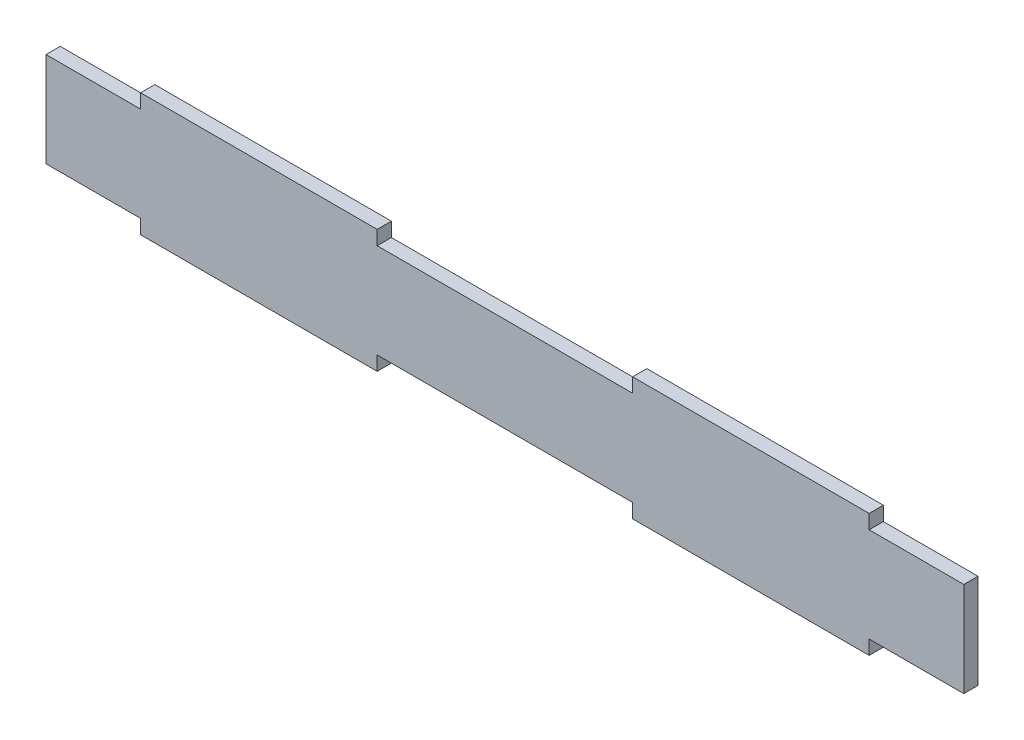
SolidWorks part; units mm, degrees
ref_plane "Front Plane" through (0, 0, 0) normal (0, 0, 1) x (1, 0, 0)
ref_plane "Top Plane" through (0, 0, 0) normal (0, 1, 0) x (1, 0, 0)
ref_plane "Right Plane" through (0, 0, 0) normal (1, 0, 0) x (0, 0, -1)
sketch "Sketch1" plane through (0, 0, 0) normal (0, 0, 1) x (1, 0, 0)
  line L0 (0, 20) -> (20, 20) construction
  line L1 (0, 0) -> (194, 0)
  line L2 (0, 0) -> (0, 20)
  line L3 (0, 20) -> (194, 20)
  line L4 (194, 0) -> (194, 20)
  line L5 (97, 20) -> (97, 0) construction
  line L6 (20, 20) -> (70, 20)
  line L7 (20, 20) -> (20, 23)
  line L8 (20, 23) -> (70, 23)
  line L9 (70, 20) -> (70, 23)
  line L10 (0, 10) -> (194, 10) construction
  line L11 (124, 20) -> (124, 23)
  line L12 (174, 23) -> (124, 23)
  line L13 (174, 20) -> (174, 23)
  line L14 (174, 20) -> (124, 20)
  line L15 (174, 0) -> (124, 0)
  line L16 (174, 0) -> (174, -3)
  line L17 (174, -3) -> (124, -3)
  line L18 (124, 0) -> (124, -3)
  line L19 (70, 0) -> (70, -3)
  line L20 (20, -3) -> (70, -3)
  line L21 (20, 0) -> (20, -3)
  line L22 (20, 0) -> (70, 0)
  dimension "D1" = 20
  dimension "D2" = 194
  dimension "D3" = 20
  dimension "D4" = 3
  dimension "D5" = 50
extrude "Boss-Extrude1" add sketch "Sketch1" along normal blind 3 contours L2 L3 L4 L1 | L8 L9 L6 L7 | L20 L19 L22 L21 | L12 L11 L14 L13 | L17 L18 L15 L16
